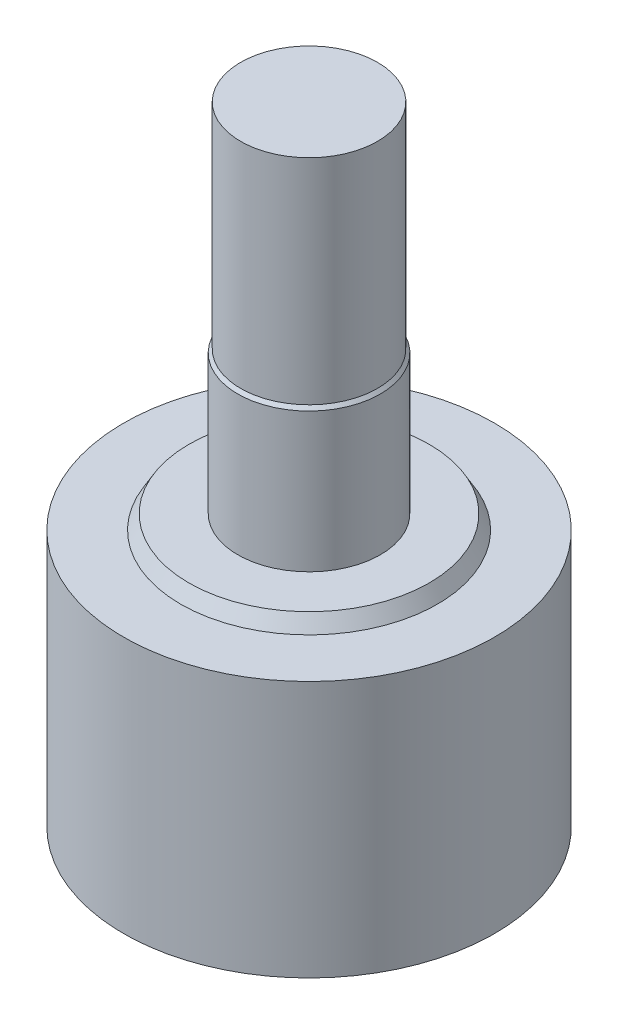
SolidWorks part; units mm, degrees
ref_plane "Front" through (0, 0, 0) normal (0, 0, 1) x (1, 0, 0)
ref_plane "Top" through (0, 0, 0) normal (0, 1, 0) x (1, 0, 0)
ref_plane "Right" through (0, 0, 0) normal (1, 0, 0) x (0, 0, -1)
sketch "Sketch1" plane through (0, 0, 0) normal (0, 0, 1) x (1, 0, 0)
  line L0 (0, 0) -> (0, 30.3621) construction
  line L1 (0, 0) -> (4.2113, 0)
  line L2 (4.2113, 0) -> (4.5, 0.5)
  line L3 (4.5, 0.5) -> (6.5, 0.5)
  line L4 (6.5, 0.5) -> (6.5, 9.5)
  line L5 (6.5, 9.5) -> (4.5, 9.5)
  line L6 (4.5, 9.5) -> (4.2113, 10)
  line L7 (4.2113, 10) -> (2.5, 10)
  line L8 (2.5, 10) -> (2.5, 14.8808)
  line L9 (2.5, 14.8808) -> (2.4, 15)
  line L10 (2.4, 15) -> (2.4, 22.5)
  line L11 (2.4, 22.5) -> (0, 22.5)
  line L12 (0, 22.5) -> (0, 0)
  dimension "D1" = 120
  dimension "D2" = 120
  dimension "D3" = 140
  dimension "D4" = 0.5
  dimension "D5" = 0.5
  dimension "D6" = 13
  dimension "D7" = 9
  dimension "D8" = 13
  dimension "D9" = 5
  dimension "D10" = 7.5
  dimension "D11" = 0.1
  dimension "D12" = 2
revolve "Revolve1" add sketch "Sketch1" angle 360 about L0
